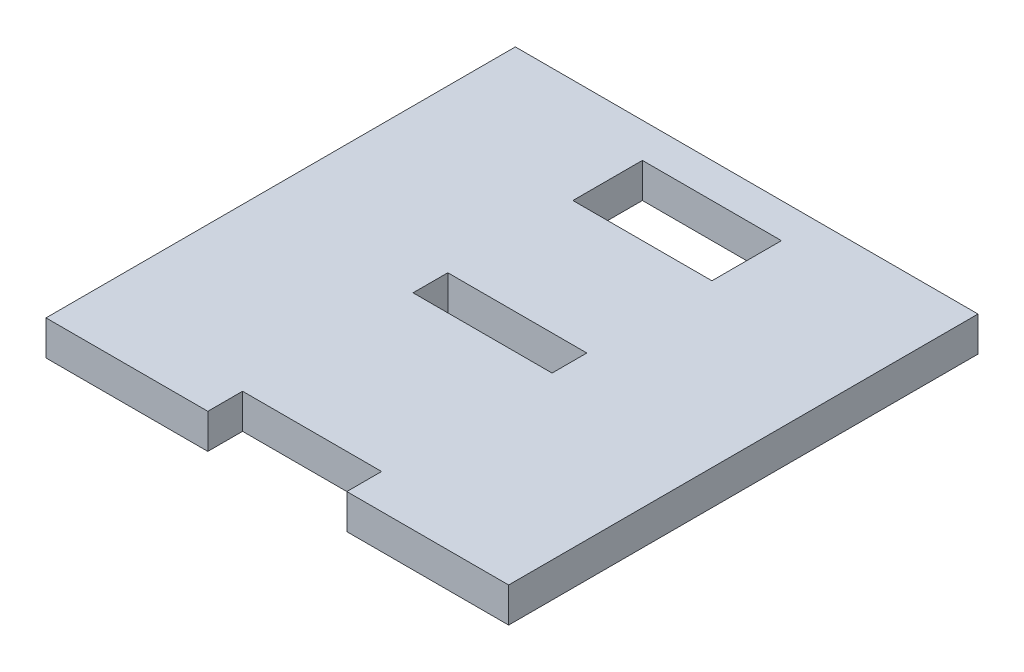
SolidWorks part; units mm, degrees
ref_plane "Front Plane" through (0, 0, 0) normal (0, 0, 1) x (1, 0, 0)
ref_plane "Top Plane" through (0, 0, 0) normal (0, 1, 0) x (1, 0, 0)
ref_plane "Right Plane" through (0, 0, 0) normal (1, 0, 0) x (0, 0, -1)
sketch "Sketch1" plane through (0, 0, 0) normal (0, 1, 0) x (1, 0, 0)
  line L0 (23.2803, 104.8614) -> (0, 104.8614) construction
  line L1 (0, 0) -> (66.5607, 0) construction
  line L2 (0, 0) -> (0, 114.8614) construction
  line L3 (0, 114.8614) -> (66.5607, 114.8614)
  line L4 (66.5607, 0) -> (66.5607, 114.8614) construction
  line L5 (23.2803, 109.8614) -> (43.2804, 109.8614)
  line L6 (23.2803, 109.8614) -> (23.2803, 99.8614)
  line L7 (23.2803, 99.8614) -> (43.2804, 99.8614)
  line L8 (43.2804, 109.8614) -> (43.2804, 99.8614)
  line L9 (23.2804, 5) -> (43.2803, 5) construction
  line L10 (23.2804, 5) -> (23.2803, 10) construction
  line L11 (23.2803, 10) -> (43.2804, 10) construction
  line L12 (43.2803, 5) -> (43.2804, 10) construction
  line L13 (23.2804, 47.338) -> (43.2803, 47.338) construction
  line L14 (23.2804, 47.338) -> (23.2803, 52.338)
  line L15 (23.2803, 52.338) -> (43.2804, 52.338)
  line L16 (43.2803, 47.338) -> (43.2804, 52.338)
  line L17 (23.2804, 76.8642) -> (43.2803, 76.8642)
  line L18 (23.2804, 76.8642) -> (23.2803, 81.8642)
  line L19 (23.2803, 81.8642) -> (43.2804, 81.8642)
  line L20 (43.2803, 76.8642) -> (43.2804, 81.8642)
  line L21 (43.2804, 104.8614) -> (66.5607, 104.8614) construction
  line L22 (0, 114.8614) -> (0, 47.338)
  line L23 (0, 47.338) -> (23.2804, 47.338)
  line L24 (43.2803, 47.338) -> (66.5607, 47.338)
  line L25 (66.5607, 47.338) -> (66.5607, 114.8614)
  point P25 (33.2803, 5)
  dimension "D1" = 114.8614
  dimension "D2" = 66.5607
  dimension "D3" = 20
  dimension "D4" = 5
  dimension "D5" = 10
  dimension "D6" = 5
  dimension "D7" = 5
  dimension "D8" = 37.338
  dimension "D9" = 24.5262
extrude "Boss-Extrude1" add sketch "Sketch1" along normal blind 5
